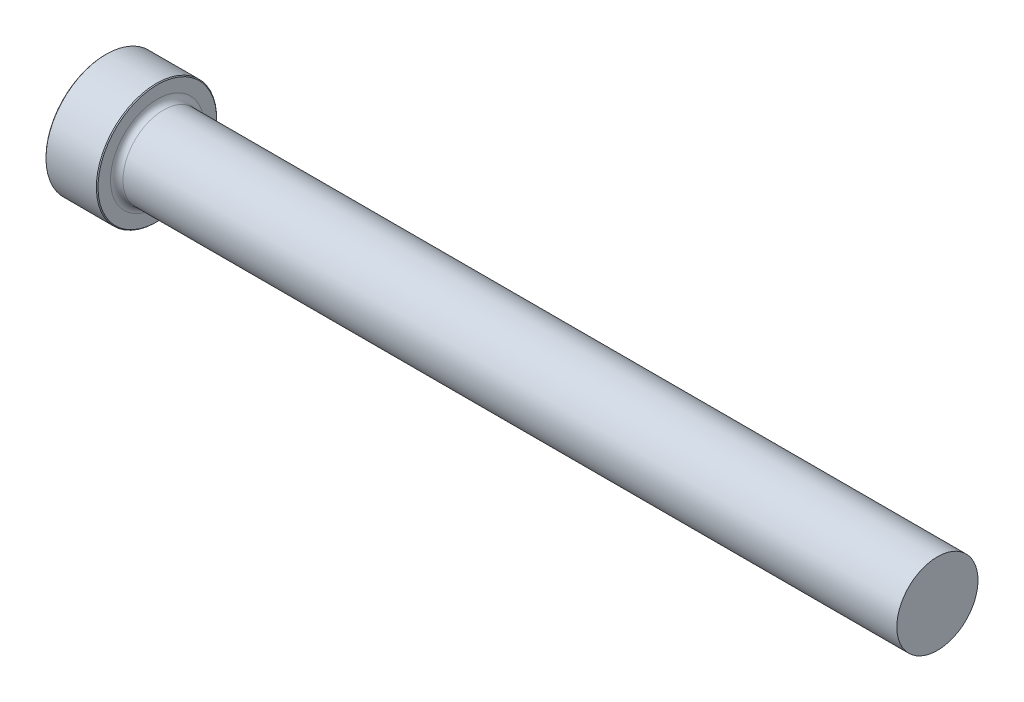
SolidWorks part; units mm, degrees
ref_plane "Front Plane" through (0, 0, 0) normal (0, 0, 1) x (1, 0, 0)
ref_plane "Top Plane" through (0, 0, 0) normal (0, 1, 0) x (1, 0, 0)
ref_plane "Right Plane" through (0, 0, 0) normal (1, 0, 0) x (0, 0, -1)
sketch "Sketch1" plane through (0, 0, 0) normal (0, 0, 1) x (1, 0, 0)
  line L0 (0, 0) -> (0, 7.3422)
  line L1 (0, 7.3422) -> (6.35, 7.3422)
  line L2 (6.35, 7.3422) -> (6.35, 5.7191)
  line L3 (7.112, 4.9571) -> (101.6, 4.9571)
  line L4 (101.6, 4.9571) -> (101.6, 0)
  line L5 (101.6, 0) -> (0, 0)
  line L6 (101.6, 0) -> (101.6, -4.9571) construction
  line L7 (101.6, -4.9571) -> (6.35, -4.9571) construction
  line L8 (0, 0) -> (0, -7.3422) construction
  line L9 (0, -7.3422) -> (6.35, -7.3422) construction
  line L10 (6.35, -7.3422) -> (6.35, -4.9571) construction
  arc A0 (6.35, 5.7191) -> (7.112, 4.9571) centre (7.112, 5.7191) ccw
  dimension "D4" = 0.762
  dimension "L" = 101.6
  dimension "D" = 9.9143
  dimension "H" = 14.6844
  dimension "T" = 6.35
revolve "Revolve1" add sketch "Sketch1" angle 360 about L5
chamfer "Chamfer1" distance 0.1016 angle 45 2 edges at (0, 7.3422, 0) (6.35, 7.3422, 0)
